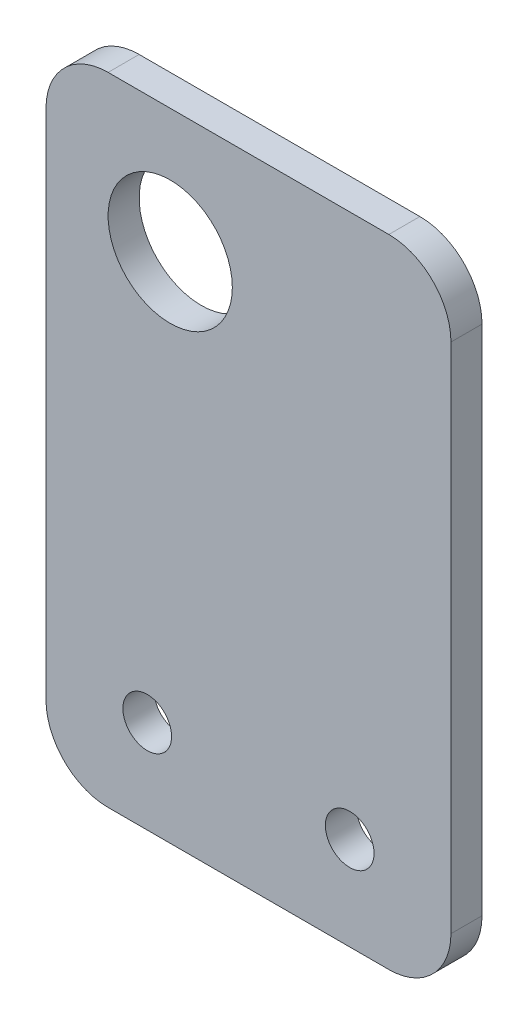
SolidWorks part; units mm, degrees
ref_plane "Front" through (0, 0, 0) normal (0, 0, 1) x (1, 0, 0)
ref_plane "Top" through (0, 0, 0) normal (0, 1, 0) x (1, 0, 0)
ref_plane "Right" through (0, 0, 0) normal (1, 0, 0) x (0, 0, -1)
sketch "Sketch1" plane through (0, 0, 0) normal (0, 0, 1) x (1, 0, 0)
  line L0 (-12.7, -42.8625) -> (8.001, -42.8625) construction
  line L1 (-12.7, 12.7) -> (28.702, 12.7)
  line L2 (-12.7, 12.7) -> (-12.7, -52.3875)
  line L3 (-12.7, -52.3875) -> (28.702, -52.3875)
  line L4 (28.702, 12.7) -> (28.702, -52.3875)
  line L5 (-12.7, 12.7) -> (28.702, -52.3875) construction
  line L6 (-12.7, -52.3875) -> (28.702, 12.7) construction
  line L7 (8.001, -52.3875) -> (8.001, -19.8438) construction
  line L8 (8.001, -42.8625) -> (28.702, -42.8625) construction
  circle A0 centre (0, 0) radius 6.35
  circle A1 centre (0, 0) radius 12.7
  circle A2 centre (-2.3495, -42.8625) radius 2.4892
  circle A3 centre (18.3515, -42.8625) radius 2.4892
  point P3 (8.001, -19.8438)
  point P17 (18.3515, -42.8625)
  point P19 (-2.3495, -42.8625)
  dimension "D1" = 12.7
  dimension "D4" = 6.35
  dimension "D6" = 4.9784
  dimension "D2" = 41.402
  dimension "D3" = 52.3875
  dimension "D5" = 19.05
extrude "Boss-Extrude1" add sketch "Sketch1" along normal blind 3.175 contours A1 L2 L3 L4 L1 | A1 A0 | A1 L1 L2
fillet "Fillet1" radius 6.35 4 edges at (-12.7, -52.3875, 1.5875) (28.702, -52.3875, 1.5875) (28.702, 12.7, 1.5875) (-12.7, 12.7, 1.5875)
